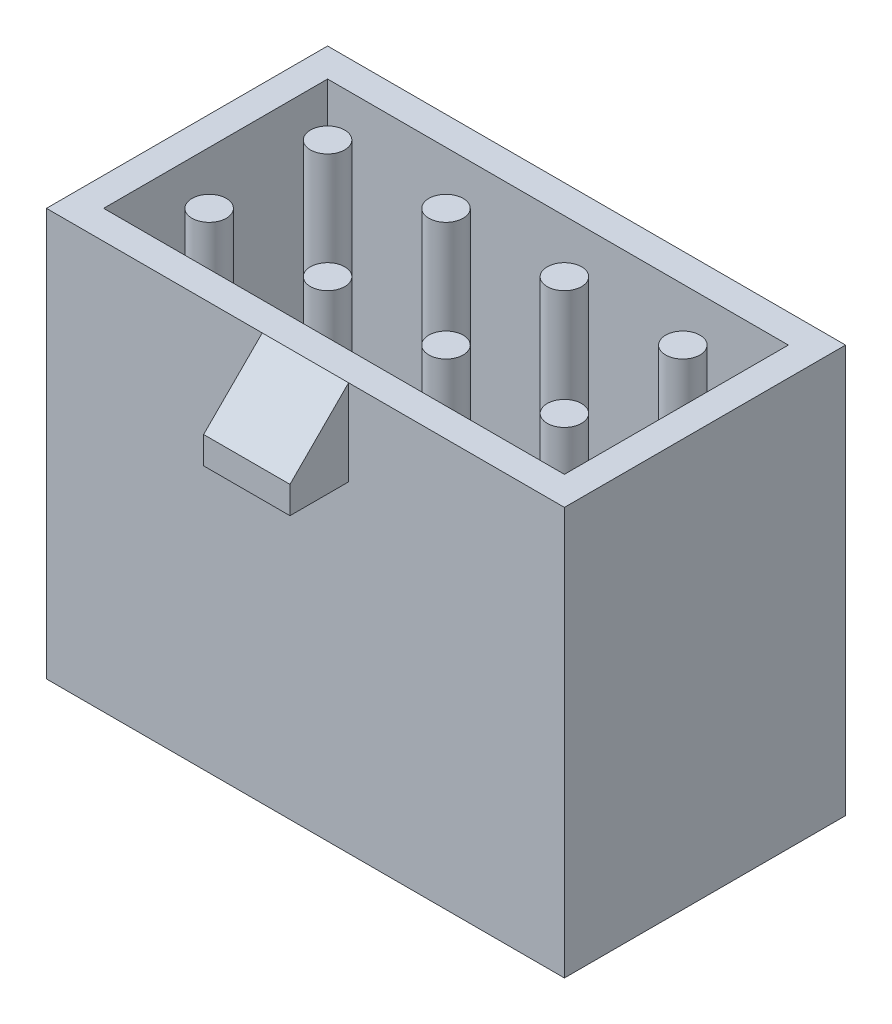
SolidWorks part; units mm, degrees
ref_plane "Front Plane" through (0, 0, 0) normal (0, 0, 1) x (1, 0, 0)
ref_plane "Top Plane" through (0, 0, 0) normal (0, 1, 0) x (1, 0, 0)
ref_plane "Right Plane" through (0, 0, 0) normal (1, 0, 0) x (0, 0, -1)
sketch "Sketch1" plane through (0, 0, 0) normal (0, 1, 0) x (1, 0, 0)
  line L1 (0, 0) -> (18.11, 0)
  line L2 (0, 0) -> (0, 9.83)
  line L3 (0, 9.83) -> (18.11, 9.83)
  line L4 (18.11, 0) -> (18.11, 9.83)
  dimension "D1" = 18.11
  dimension "D2" = 9.83
extrude "Extrude1" add sketch "Sketch1" along normal blind 14.25
sketch "Sketch2" plane through (0, 14.25, 0) normal (0, 1, 0) x (-1, 0, 0)
  line L0 (0, 0) -> (-18.11, 0) construction
  line L1 (-17.11, -1) -> (-1, -1)
  line L2 (-17.11, -1) -> (-17.11, -8.83)
  line L3 (-17.11, -8.83) -> (-1, -8.83)
  line L4 (-1, -1) -> (-1, -8.83)
  line L5 (-18.11, 0) -> (-18.11, -9.83) construction
  line L6 (-17.11, -4.915) -> (-1, -4.915) construction
  line L7 (-9.055, -1) -> (-9.055, -8.83) construction
  circle A0 centre (-15.265, -2.845) radius 0.6
  circle A1 centre (-11.125, -2.845) radius 0.6
  circle A2 centre (-11.125, -6.985) radius 0.6
  circle A3 centre (-15.265, -6.985) radius 0.6
  circle A4 centre (-2.845, -6.985) radius 0.6
  circle A5 centre (-6.985, -6.985) radius 0.6
  circle A6 centre (-6.985, -2.845) radius 0.6
  circle A7 centre (-2.845, -2.845) radius 0.6
  dimension "D5" = 1.2
  dimension "D6" = 1.2
  dimension "D1" = 16.11
  dimension "D2" = 7.83
  dimension "D3" = 1
  dimension "D4" = 1
  dimension "D7" = 4.14
  dimension "D8" = 4.14
  dimension "D9" = 4.14
extrude "Cut-Extrude1" cut sketch "Sketch2" against normal blind 10
sketch "Sketch3" plane through (0, 0, 0) normal (0, 0, 1) x (1, 0, 0)
  line L0 (9.055, 14.25) -> (9.055, 0) construction
  line L1 (0, 14.25) -> (18.11, 14.25) construction
  line L2 (0, 0) -> (18.11, 0) construction
  line L4 (7.545, 14.25) -> (10.565, 14.25)
  line L5 (7.545, 14.25) -> (7.545, 11.25)
  line L6 (7.545, 11.25) -> (10.565, 11.25)
  line L7 (10.565, 14.25) -> (10.565, 11.25)
  dimension "D1" = 3.02
  dimension "D2" = 1.51
  dimension "D3" = 3
extrude "Extrude2" add sketch "Sketch3" along normal blind 2.05
chamfer "Chamfer1" distance 2.05 angle 45 1 edges at (9.055, 14.25, 2.05)
sketch "Sketch4" plane through (0, 0, 0) normal (0, -1, 0) x (1, 0, 0)
  circle A0 centre (15.265, -2.845) radius 0.6 construction
  point P0 (15.265, -2.845)
